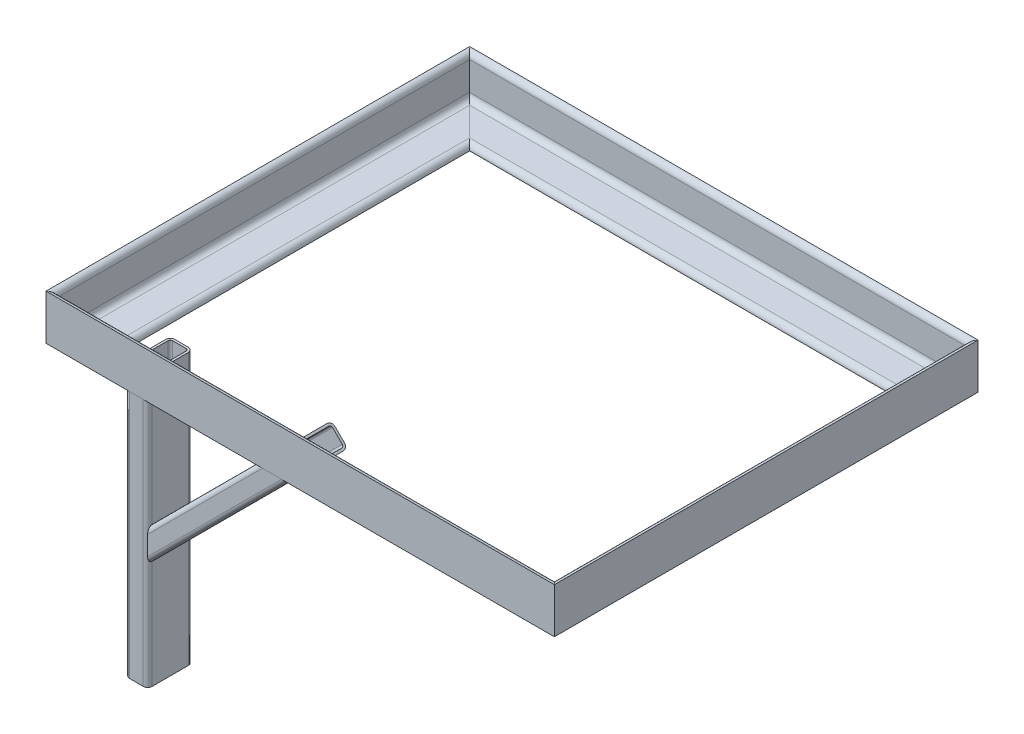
SolidWorks part; units mm, degrees
ref_plane "Front" through (0, 0, 0) normal (0, 0, 1) x (1, 0, 0)
ref_plane "Top" through (0, 0, 0) normal (0, 1, 0) x (1, 0, 0)
ref_plane "Right" through (0, 0, 0) normal (1, 0, 0) x (0, 0, -1)
ref_plane "Top of Frame" through (0, 500, 0) normal (0, 1, 0) x (-1, 0, 0)
ref_plane "Bottom of Legs" through (0, 20, 0) normal (0, 1, 0) x (-1, 0, 0)
sketch "Upper Frame" plane through (0, 500, 0) normal (0, 1, 0) x (-1, 0, 0)
  line L0 (-450, 375) -> (450, -375) construction
  line L1 (-450, -375) -> (450, -375)
  line L2 (-450, -375) -> (-450, 375)
  line L3 (-450, 375) -> (450, 375)
  line L4 (450, -375) -> (450, 375)
  dimension "D1" = 900
  dimension "D2" = 750
ref_plane "Front of Frame" through (0, 0, 375) normal (0, 0, 1) x (1, 0, 0)
sketch "Leg Sketch" plane through (0, 0, 375) normal (0, 0, 1) x (1, 0, 0)
  line L0 (0, 0) -> (0, 430.7934) construction
  line L1 (-290, 20) -> (-290, 500)
  line L2 (450, 500) -> (-450, 500) construction
  line L4 (-290, 220) -> (-10, 500)
  line L5 (50, 20) -> (-50, 20) construction
  line L6 (450, 500) -> (-450, 500) construction
  dimension "D1" = 580
  dimension "D2" = 200
  dimension "D3" = 45
other "L angle (equal) 80X80X10(2)"
ref_plane "Plane3" through (450, 460, 375) normal (-1, 0, 0) x (0, 1, 0)
sketch "Sketch1" plane through (450, 460, 375) normal (-1, 0, 0) x (0, 1, 0)
  line L0 (0, 80) -> (0, 0)
  line L2 (10, 70) -> (10, 20)
  line L3 (20, 10) -> (70, 10)
  line L5 (80, 0) -> (0, 0)
  arc A0 (10, 70) -> (0, 80) centre (0, 70) ccw
  arc A1 (80, 0) -> (70, 10) centre (70, 0) ccw
  arc A2 (20, 10) -> (10, 20) centre (20, 20) cw
  point P8 (0, 40)
  point P9 (40, 0)
  point P10 (0, 0)
  dimension "Radius_2" = 10
  dimension "Radius_1" = 10
  dimension "V_leg" = 80
  dimension "H_leg" = 80
  dimension "thickness" = 10
other "Tube (rectangular) 80 X 40 X 4.0(1)"
ref_plane "Plane4" through (-290, 20, 335) normal (0, 1, 0) x (-1, 0, 0)
sketch "Sketch17" plane through (-290, 20, 335) normal (0, 1, 0) x (-1, 0, 0)
  line L0 (-12, -36) -> (12, -36)
  line L1 (-16, -32) -> (-16, 32)
  line L2 (12, 36) -> (-12, 36)
  line L3 (16, 32) -> (16, -32)
  line L4 (-12, -40) -> (12, -40)
  line L5 (-20, -32) -> (-20, 32)
  line L6 (12, 40) -> (-12, 40)
  line L7 (20, 32) -> (20, -32)
  line L8 (-20, 0) -> (-16, 0) construction
  line L9 (-16, 0) -> (16, 0) construction
  line L10 (16, 0) -> (20, 0) construction
  line L11 (0, 40) -> (0, 36) construction
  line L12 (0, 36) -> (0, -36) construction
  line L13 (0, -36) -> (0, -40) construction
  arc A0 (20, 32) -> (12, 40) centre (12, 32) ccw
  arc A1 (12, -40) -> (20, -32) centre (12, -32) ccw
  arc A2 (-20, -32) -> (-12, -40) centre (-12, -32) ccw
  arc A3 (-12, 40) -> (-20, 32) centre (-12, 32) ccw
  arc A4 (-12, 36) -> (-16, 32) centre (-12, 32) ccw
  arc A5 (16, 32) -> (12, 36) centre (12, 32) ccw
  arc A6 (12, -36) -> (16, -32) centre (12, -32) ccw
  arc A7 (-16, -32) -> (-12, -36) centre (-12, -32) ccw
  point P6 (-20, 40)
  point P33 (-20, -40)
  point P34 (20, -40)
  point P36 (20, 40)
  point P37 (0, 0)
  dimension "D1" = 8
  dimension "Thickness" = 4
  dimension "V_leg" = 80
  dimension "H_leg" = 40
